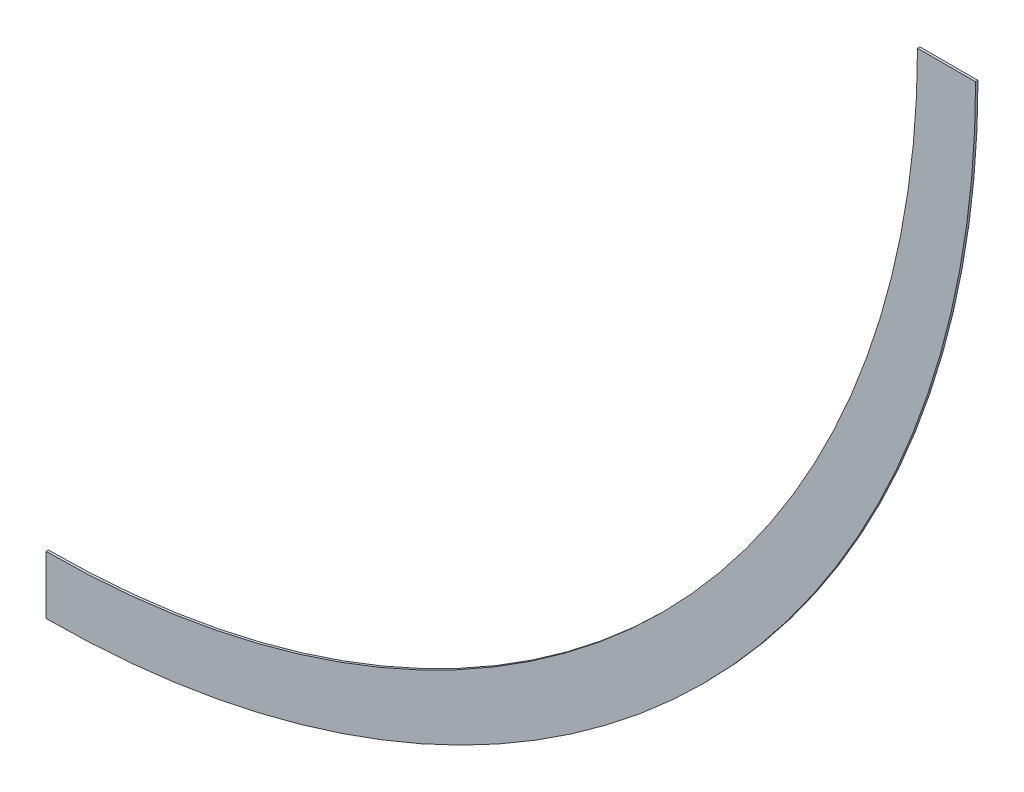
SolidWorks part; units mm, degrees
ref_plane "Front Plane" through (0, 0, 0) normal (1, 0, 0) x (0, 1, 0)
ref_plane "Top Plane" through (0, 0, 0) normal (0, 0, 1) x (0, 1, 0)
ref_plane "Right Plane" through (0, 0, 0) normal (0, 1, 0) x (-1, 0, 0)
sketch "sk 48.2in Radius wFlats" plane through (0, 0, 0) normal (0, 0, 1) x (0, 1, 0)
  line L1 (139.7375, -1137.7524) -> (139.7375, -1229.9437)
  line L2 (-1220.7484, 5.7525) -> (-1232.865, 5.7525)
  line L3 (-26.9044, -1194.1175) -> (139.7375, -1194.1175)
  line L4 (-1219.5175, 5.7525) -> (-1194.1175, 5.7525)
  line L5 (-1219.5175, 5.7525) -> (-1219.5175, -42.7296)
  line L6 (-1219.5175, -42.7296) -> (-1194.1175, -42.7296)
  line L7 (-1194.1175, 5.7525) -> (-1194.1175, -42.7296)
  line L8 (-26.9044, -1194.1175) -> (-26.9044, -1219.5175)
  line L9 (-26.9044, -1219.5175) -> (139.7375, -1219.5175)
  line L10 (139.7375, -1194.1175) -> (139.7375, -1219.5175)
  point P0 (75.7466, -1222.6925)
  point P2 (-1232.865, 5.7525)
  point P3 (139.7375, -1183.848)
  point P8 (-1224.28, 75.7378)
  point P13 (-1220.7484, 5.7525)
  line B0 (-1224.28, 75.7378) -> (-1224.28, 0)
  line B1 (0, -1224.28) -> (75.7466, -1224.28)
  line B2 (75.7466, -1222.6925) -> (75.7466, -1224.28)
  line B3 (-1222.6925, 75.7378) -> (-1222.6925, 0)
  line B4 (0, -1222.6925) -> (75.7466, -1222.6925)
  arc B5 (-1224.28, 0) -> (0, -1224.28) centre (0, 0) ccw
  arc B6 (-1222.6925, 0) -> (0, -1222.6925) centre (0, 0) ccw
  dimension "D1" = 5.7525
  dimension "D2" = 3.175
  dimension "D3" = 3.175
  dimension "D4" = 25.4
  dimension "D5" = 139.7375
  dimension "D6" = 25.4
sketch_block_instance "48.2in Radius wFlats-1"
sketch_block "48.2in Radius wFlats"
ref_plane "N pln" through (1224.28, 0, 0) normal (1, 0, 0) x (0, 1, 0)
ref_plane "E pln" through (0, -1224.28, 0) normal (0, 1, 0) x (-1, 0, 0)
sketch "Sketch9" plane through (0, 0, 0) normal (0, 0, 1) x (0, 1, 0)
  line L0 (-1143.3175, 75.7378) -> (-1219.5175, 75.7378)
  line L2 (-1143.3175, 75.7378) -> (-1143.3175, 0)
  line L3 (0, -1143.3175) -> (75.7466, -1143.3175)
  line L4 (0, -1219.5175) -> (75.7466, -1219.5175)
  line L5 (-1219.5175, 75.7378) -> (-1219.5175, 0)
  line L6 (0, -1219.5175) -> (75.7466, -1219.5175)
  line L7 (-1219.5175, 75.7378) -> (-1219.5175, 0)
  line L8 (75.7466, -1219.5175) -> (75.7466, -1143.3175)
  arc A1 (-1143.3175, 0) -> (0, -1143.3175) centre (0, 0) ccw
  arc A2 (-1219.5175, 0) -> (0, -1219.5175) centre (0, 0) ccw
  arc A3 (-1219.5175, 0) -> (0, -1219.5175) centre (0, 0) ccw
  dimension "D1" = 3.175
  dimension "D2" = 76.2
ref_plane "E tab lower" through (0, -1194.1175, 0) normal (0, 1, 0) x (-1, 0, 0)
extrude "Main body" add sketch "Sketch9" along normal mid plane 3.175
sketch "Sketch10" plane through (0, 0, 0) normal (0, 0, 1) x (0, 1, 0)
  line L8 (0, -1309.9047) -> (381.5519, -1309.9047)
  line L9 (381.5519, -1309.9047) -> (381.5519, 358.876)
  line L10 (381.5519, 358.876) -> (-1266.3855, 358.876)
  line L11 (-1266.3855, 358.876) -> (-1294.2915, 0)
  line L12 (-1294.2915, 0) -> (0, 0)
  line L14 (0, -1309.9047) -> (0, 0)
  point P4 (154.0893, 133.5183)
extrude "Cut-Extrude1" cut sketch "Sketch10" against normal through all both and the other way through all
